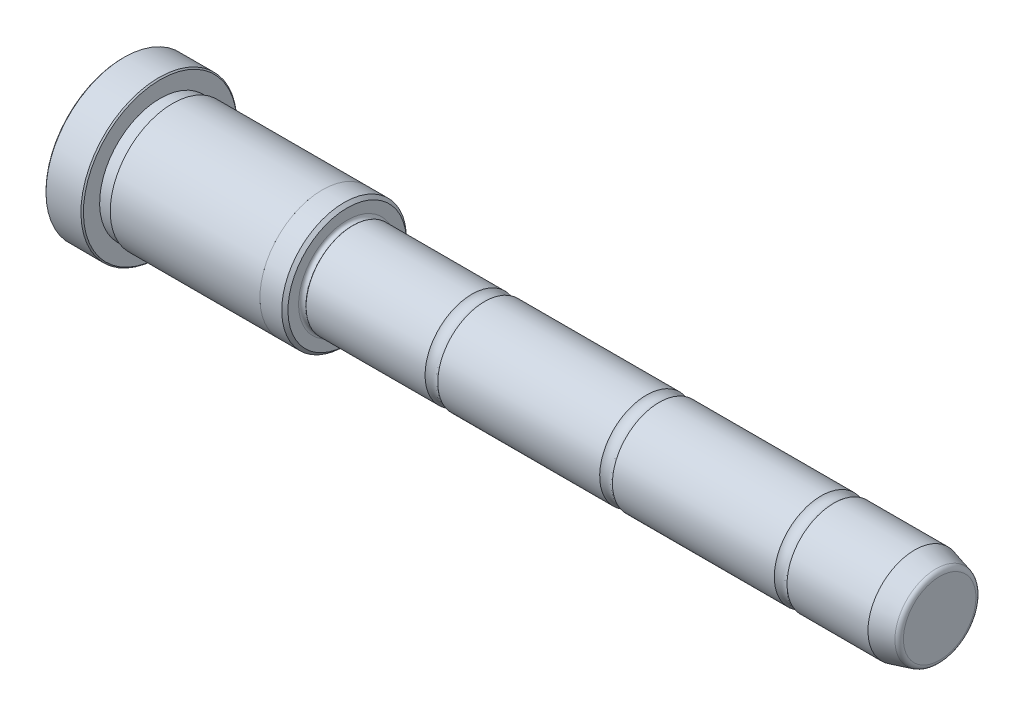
SolidWorks part; units mm, degrees
ref_plane "Front Plane" through (0, 0, 0) normal (0, 0, 1) x (1, 0, 0)
ref_plane "Top Plane" through (0, 0, 0) normal (0, 1, 0) x (1, 0, 0)
ref_plane "Right Plane" through (0, 0, 0) normal (1, 0, 0) x (0, 0, -1)
sketch "Sketch1" plane through (0, 0, 0) normal (0, 0, 1) x (1, 0, 0)
  line L0 (95, 6.4282) -> (91, 7.5)
  line L1 (91, 7.5) -> (0.9, 7.5)
  line L2 (0, 7.8) -> (0, 10)
  line L3 (0, 10) -> (-4, 10)
  line L4 (-28, 10.001) -> (-28, 9.7)
  line L5 (-28, 9.7) -> (-30, 9.7)
  line L6 (-30, 9.7) -> (-30, 12.5)
  line L7 (-30, 12.5) -> (-36, 12.5)
  line L8 (-36, 12.5) -> (-36, 0)
  line L9 (-28, 10.001) -> (-4, 10.001)
  line L10 (-4, 10.001) -> (-4, 10)
  line L13 (95, 6.4282) -> (95, 0)
  line L14 (95, 0) -> (-95, 0) construction
  line L15 (95, 0) -> (-36, 0)
  arc A0 (0, 7.8) -> (0.9, 7.5) centre (0.5, 7.8) ccw
  point P16 (0, 0)
  dimension "ShoulderRadii" = 1
  dimension "D1" = 15
  dimension "D2" = 0.3
  dimension "PinDia" = 15
  dimension "ChamferLeadIn" = 4
  dimension "ShoulderDia" = 20
  dimension "PinLengthN" = 95
  dimension "ShoulderLength" = 36
  dimension "D3" = 4
  dimension "ShoulderGap" = 2
  dimension "D4" = 0.001
  dimension "T" = 6
  dimension "HeadDia" = 25
  dimension "D8" = 0.2
revolve "Revolve1" add sketch "Sketch1" angle 360 about L14
sketch "Sketch2" plane through (0, 0, 0) normal (0, 0, 1) x (1, 0, 0)
  line L0 (95, -6.4282) -> (95, 6.4282) construction
  line L1 (0.9, 7.1) -> (91, 7.1) construction
  line L2 (91, 7.5) -> (0.9, 7.5) construction
  line L3 (0.9, 7.5) -> (0.9, -7.5) construction
  line L4 (75.9802, 7.5) -> (78.0198, 7.5)
  line L5 (91, 7.5) -> (91, -7.5) construction
  arc A0 (75.9802, 7.5) -> (78.0198, 7.5) centre (77, 8.6) ccw
  dimension "GrooveRadius" = 1.5
  dimension "D3" = 0.4
  dimension "AGroove" = 18
revolve "Groove A" cut sketch "Sketch2" angle 360 about axis through (95, 0, 0) along (1, 0, 0)
sketch "Sketch3" plane through (0, 0, 0) normal (0, 0, 1) x (1, 0, 0)
  line L1 (75.9802, 7.5) -> (0.9, 7.5) construction
  line L3 (47.9802, 7.5) -> (50.0198, 7.5)
  arc A0 (47.9802, 7.5) -> (50.0198, 7.5) centre (49, 8.6) ccw
  arc A1 (75.9802, 7.5) -> (78.0198, 7.5) centre (77, 8.6) ccw construction
  dimension "D1" = 0.4
  dimension "GroovePitch" = 28
revolve "Groove B" cut sketch "Sketch3" angle 360 about axis through (95, 0, 0) along (1, 0, 0)
sketch "Sketch4" plane through (0, 0, 0) normal (0, 0, 1) x (1, 0, 0)
  line L2 (47.9802, 7.5) -> (0.9, 7.5) construction
  line L3 (19.9802, 7.5) -> (22.0198, 7.5)
  arc A0 (19.9802, 7.5) -> (22.0198, 7.5) centre (21, 8.6) ccw
  arc A3 (47.9802, 7.5) -> (50.0198, 7.5) centre (49, 8.6) ccw construction
  dimension "D1" = 0.4
revolve "Groove C" cut sketch "Sketch4" angle 360 about axis through (95, 0, 0) along (1, 0, 0)
sketch "Sketch5" [suppressed] plane through (0, 0, 0) normal (0, 0, 1) x (1, 0, 0)
  line L0 (43.5033, 21) -> (46.4967, 21)
  line L1 (83.5033, 21) -> (2.2483, 21) construction
  arc A0 (43.5033, 21) -> (46.4967, 21) centre (45, 23.6) ccw
  arc A3 (83.5033, 21) -> (86.4967, 21) centre (85, 23.6) ccw construction
  dimension "D1" = 0.4
revolve "Groove D" [suppressed] cut sketch "Sketch5" angle 360
fillet "Fillet1" radius 0.8 1 edges at (95, 6.4282, 0)
chamfer "Chamfer1" distance 0.2 angle 45 2 edges at (-36, 12.5, 0) (-30, 12.5, 0)
chamfer "Chamfer2" distance 0.5 angle 45 1 edges at (0, 10, 0)
